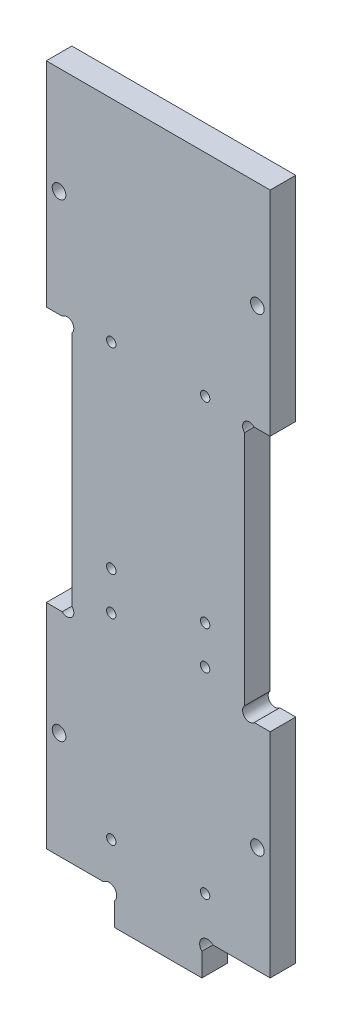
SolidWorks part; units mm, degrees
ref_plane "Plan de face" through (0, 0, 0) normal (0, 0, 1) x (1, 0, 0)
ref_plane "Plan de dessus" through (0, 0, 0) normal (0, 1, 0) x (1, 0, 0)
ref_plane "Plan de droite" through (0, 0, 0) normal (1, 0, 0) x (0, 0, -1)
sketch "Esquisse1" plane through (0, 0, 0) normal (0, 0, 1) x (1, 0, 0)
  line L0 (0, -27.2905) -> (0, 202.9394) construction
  line L1 (-9.2865, 0) -> (85.249, 0) construction
  line L2 (52.5, -5.8652) -> (52.5, 202.9394) construction
  line L3 (-9.2865, 168) -> (85.249, 168) construction
  line L4 (46.5, 191.4905) -> (46.5, 4.5685) construction
  line L5 (78.133, 8) -> (-9.2865, 8) construction
  line L6 (16, -19.1121) -> (16, 15.3411) construction
  line L7 (16, 8) -> (-1.555, -9.555) construction
  line L8 (49.5, 59.8327) -> (49.5, 34.7157) construction
  line L9 (35.2621, 58) -> (68.6638, 58) construction
  line L10 (63.3533, 33) -> (39.9073, 33) construction
  line L11 (46.5, 58) -> (63.3533, 74.8533) construction
  line L12 (48.7627, 58) -> (52.5, 58)
  line L13 (52.5, 58) -> (52.5, 8)
  line L14 (16, 5.4327) -> (16, 0)
  line L15 (39.0673, 8) -> (52.5, 8)
  line L16 (13.4327, 8) -> (0, 8)
  line L17 (0, 8) -> (0, 58)
  line L18 (0, 168) -> (52.5, 168)
  line L19 (26.25, -27.2905) -> (26.25, 15.3411) construction
  line L20 (42.76, 88) -> (74.7784, 88) construction
  line L21 (36.5, 5.4327) -> (36.5, 0)
  line L22 (16, 0) -> (36.5, 0)
  line L23 (52.5, 118) -> (52.5, 168)
  line L24 (48.7627, 118) -> (52.5, 118)
  line L25 (46.5, 115.7373) -> (46.5, 60.2627)
  line L26 (6, 115.7373) -> (6, 60.2627)
  line L27 (3.7373, 118) -> (0, 118)
  line L28 (3.7373, 58) -> (0, 58)
  line L29 (0, 118) -> (0, 168)
  line L30 (44.4651, 17.5) -> (-9.2865, 17.5) construction
  line L31 (44.4651, 63.5) -> (-9.2865, 63.5) construction
  line L32 (15.25, 16.4202) -> (15.25, 86.0168) construction
  line L33 (37.25, 16.4202) -> (37.25, 86.0168) construction
  line L34 (8.6294, 68) -> (32.4115, 68) construction
  circle A0 centre (49.5, 33) radius 1.6
  arc A1 (46.5, 60.2627) -> (48.7627, 58) centre (47.6314, 59.1314) ccw
  arc A2 (16, 5.4327) -> (13.4327, 8) centre (14.7164, 6.7164) ccw
  arc A3 (36.5, 5.4327) -> (39.0673, 8) centre (37.7836, 6.7164) cw
  arc A4 (46.5, 115.7373) -> (48.7627, 118) centre (47.6314, 116.8686) cw
  circle A5 centre (49.5, 143) radius 1.6
  circle A6 centre (3, 143) radius 1.6
  circle A7 centre (3, 33) radius 1.6
  arc A8 (6, 115.7373) -> (3.7373, 118) centre (4.8686, 116.8686) ccw
  arc A9 (6, 60.2627) -> (3.7373, 58) centre (4.8686, 59.1314) cw
  circle A10 centre (15.25, 63.5) radius 1.1
  circle A11 centre (37.25, 63.5) radius 1.1
  circle A12 centre (37.25, 17.5) radius 1.1
  circle A13 centre (15.25, 17.5) radius 1.1
  circle A14 centre (15.25, 118.5) radius 1.1
  circle A15 centre (37.25, 118.5) radius 1.1
  circle A16 centre (37.25, 72.5) radius 1.1
  circle A17 centre (15.25, 72.5) radius 1.1
  dimension "D11" = 46
  dimension "D13" = 22
  dimension "D14" = 11
  dimension "D2" = 9.5
  dimension "D3" = 8
  dimension "D4" = 80
  dimension "D5" = 45
  dimension "D6" = 6
  dimension "D7" = 50
  dimension "D8" = 25
  dimension "D9" = 3
  dimension "D10" = 45
  dimension "D12" = 10.25
  dimension "D15" = 4.5
extrude "Boss.-Extru.1" add sketch "Esquisse1" along normal blind 6
